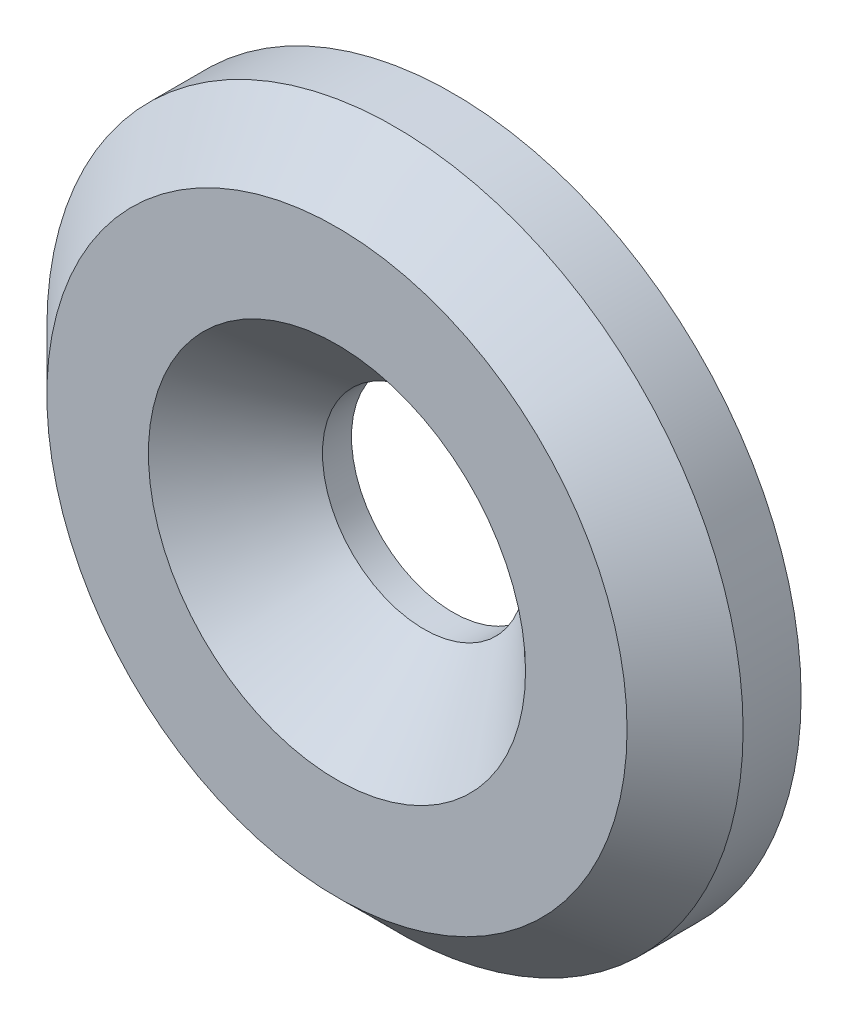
SolidWorks part; units mm, degrees
ref_plane "Plan de face" through (0, 0, 0) normal (0, 0, 1) x (1, 0, 0)
ref_plane "Plan de dessus" through (0, 0, 0) normal (0, 1, 0) x (1, 0, 0)
ref_plane "Plan de droite" through (0, 0, 0) normal (1, 0, 0) x (0, 0, -1)
sketch "Esquisse1" plane through (0, 0, 0) normal (0, 0, 1) x (1, 0, 0)
  circle A0 centre (0, 0) radius 1.75
  circle A1 centre (0, 0) radius 6
  dimension "D1" = 3.5
  dimension "D2" = 12
extrude "Boss.-Extru.1" add sketch "Esquisse1" along normal blind 2
chamfer "Chanfrein1" distance 1 angle 45 1 edges at (6, 0, 2)
chamfer "Chanfrein3" distance 1.5 angle 45 1 edges at (1.75, 0, 2)
